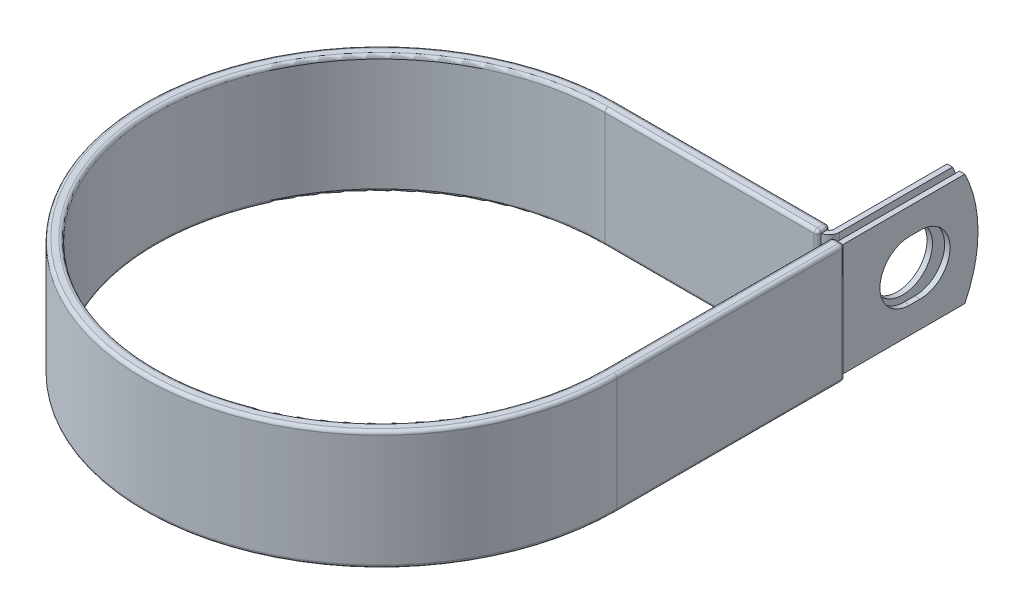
SolidWorks part; units mm, degrees
ref_plane "Front Plane" through (0, 0, 0) normal (0, 0, 1) x (1, 0, 0)
ref_plane "Top Plane" through (0, 0, 0) normal (0, 1, 0) x (1, 0, 0)
ref_plane "Right Plane" through (0, 0, 0) normal (1, 0, 0) x (0, 0, -1)
sketch "Sketch1" plane through (0, 0, 0) normal (0, 1, 0) x (1, 0, 0)
  line L0 (0, 51.5938) -> (47.6415, 51.5938)
  line L1 (51.5938, 0) -> (51.5938, 51.5938)
  line L2 (50.0189, 82.5246) -> (50.0189, 53.9712)
  line L5 (51.5938, 51.5938) -> (51.5938, 82.5246)
  arc A0 (0, 51.5938) -> (51.5938, 0) centre (0, 0) ccw
  arc A3 (47.6415, 51.5938) -> (50.0189, 53.9712) centre (47.6415, 53.9712) ccw
extrude "Extrude-Thin1" add sketch "Sketch1" along normal mid plane 25.4 thin
sketch "Sketch2" plane through (48.7997, 0, 0) normal (-1, 0, 0) x (0, 0, 1)
  line L0 (-82.5246, 12.7) -> (-82.5246, -12.7) construction
  line L7 (0, 12.7) -> (0, -12.7) construction
  circle A0 centre (-68.2498, 0) radius 6.7437
  point P2 (-82.5246, 0)
extrude "Cut-Extrude1" cut sketch "Sketch2" against normal up to surface (1.2192 mm away)
sketch "Sketch3" plane through (52.813, 0, 0) normal (1, 0, 0) x (0, 0, -1)
  line L0 (67.056, 0) -> (69.4436, 0) construction
  line L1 (67.056, 6.7437) -> (69.4436, 6.7437)
  line L2 (67.056, -6.7437) -> (69.4436, -6.7437)
  line L3 (82.5246, 12.7) -> (82.5246, -12.7) construction
  arc A0 (67.056, 6.7437) -> (67.056, -6.7437) centre (67.056, 0) ccw
  arc A1 (69.4436, -6.7437) -> (69.4436, 6.7437) centre (69.4436, 0) ccw
  point P3 (68.2498, 0)
  point P8 (82.5246, 0)
  point P11 (60.3123, 0)
  point P12 (76.1873, 0)
extrude "Cut-Extrude2" cut sketch "Sketch3" against normal up to surface (1.2192 mm away)
sketch "Sketch4" plane through (48.7997, 0, 0) normal (-1, 0, 0) x (0, 0, 1)
  line L0 (-82.5246, 12.7) -> (-82.5246, -12.7)
  line L1 (-82.5246, 12.7) -> (-79.5473, 12.7)
  line L2 (-82.5246, 12.7) -> (-53.9712, 12.7) construction
  line L3 (-82.5246, -12.7) -> (-79.5473, -12.7)
  line L4 (-82.5246, -12.7) -> (-53.9712, -12.7) construction
  arc A0 (-79.5473, 12.7) -> (-79.5473, -12.7) centre (-53.9496, 0) ccw
extrude "Cut-Extrude3" cut sketch "Sketch4" against normal through all contours A0 M4 M5 | A0 L0 M2
ref_plane "Plane1" through (0, 0, -51.5938) normal (0, 0, 1) x (1, 0, 0)
ref_plane "Plane2" through (0, 0, 0) normal (-1, 0, 0) x (0, 0, 1)
sketch "Sketch5" plane through (0, 0, -51.5938) normal (0, 0, 1) x (1, 0, 0)
  line L0 (51.5938, 12.7) -> (52.813, 12.7)
  line L1 (51.5938, -12.7) -> (51.5938, 12.7)
  line L2 (50.8, -12.7317) -> (50.8, 12.7317)
  line L3 (52.813, 12.7) -> (52.813, -12.7)
  line L4 (52.813, -12.7) -> (51.5938, -12.7)
  line L5 (51.562, 13.4937) -> (52.8447, 13.4937)
  line L7 (53.6067, 12.7317) -> (53.6067, -12.7317)
  line L8 (52.8447, -13.4937) -> (51.562, -13.4938)
  line L9 (50.8, -13.4937) -> (50.8, 13.4937) construction
  line L11 (53.6067, -13.4937) -> (50.8, -13.4937) construction
  line L12 (53.6067, 13.4937) -> (53.6067, -13.4937) construction
  line L13 (50.8, 13.4937) -> (53.6067, 13.4937) construction
  arc A0 (50.8, -12.7317) -> (51.562, -13.4938) centre (51.562, -12.7317) ccw
  arc A1 (53.6067, -12.7317) -> (52.8447, -13.4937) centre (52.8447, -12.7317) cw
  arc A2 (50.8, 12.7317) -> (51.562, 13.4937) centre (51.562, 12.7317) cw
  arc A3 (52.8447, 13.4937) -> (53.6067, 12.7317) centre (52.8447, 12.7317) cw
sketch "Sketch6" plane through (0, 12.7, 0) normal (0, 1, 0) x (1, 0, 0)
  line L0 (50.8, 0) -> (50.8, 51.5938)
  line L1 (0, 50.8) -> (48.1648, 50.8)
  line L2 (48.7998, 79.5473) -> (48.7998, 53.9712) construction
  arc A0 (0, 50.8) -> (50.8, 0) centre (0, 0) ccw
sweep "Sweep1" add profiles "Sketch5" path "Sketch6"
fillet "Fillet1" radius 0.762 16 edges at (48.1648, 13.2706, -53.3835) (48.1648, 0, -53.6067) (48.1648, -13.2706, -53.3835) (48.1648, -13.4937, -52.2033) (48.1648, -13.2706, -51.0232) (48.1648, 0, -50.8) (48.1648, 13.2706, -51.0232) (53.3835, 13.2706, -51.5938) (53.6067, 0, -51.5938) (53.3835, -13.2706, -51.5938) (52.2033, -13.4937, -51.5938) (51.0232, -13.2706, -51.5938) (50.8, 0, -51.5938) (51.0232, 13.2706, -51.5938) (48.1648, 13.4937, -52.2033) (52.2033, 13.4937, -51.5938)
equation "\"D4@Sketch5\" = \"D1@Extrude-Thin1\""
equation "\"D5@Sketch5\" = \"D5@Extrude-Thin1\""
equation "\"D1@Sketch3\" = \"D2@Sketch2\""
equation "\"D7@Sketch1\" = \"D3@Sketch2\" + \"D1@Sketch3\""
equation "\"D1@Sketch1\" = \"D1@Sketch6\" + 2 * \"D3@Sketch5\""
equation "\"D1@Sketch4\" = ( \"D1@Extrude-Thin1\" + .125 ) * 2"
equation "\"D2@Sketch1\"=1.95*\"D5@Extrude-Thin1\""
equation "\"D2@Sketch3\" = \"D1@Sketch2\""
